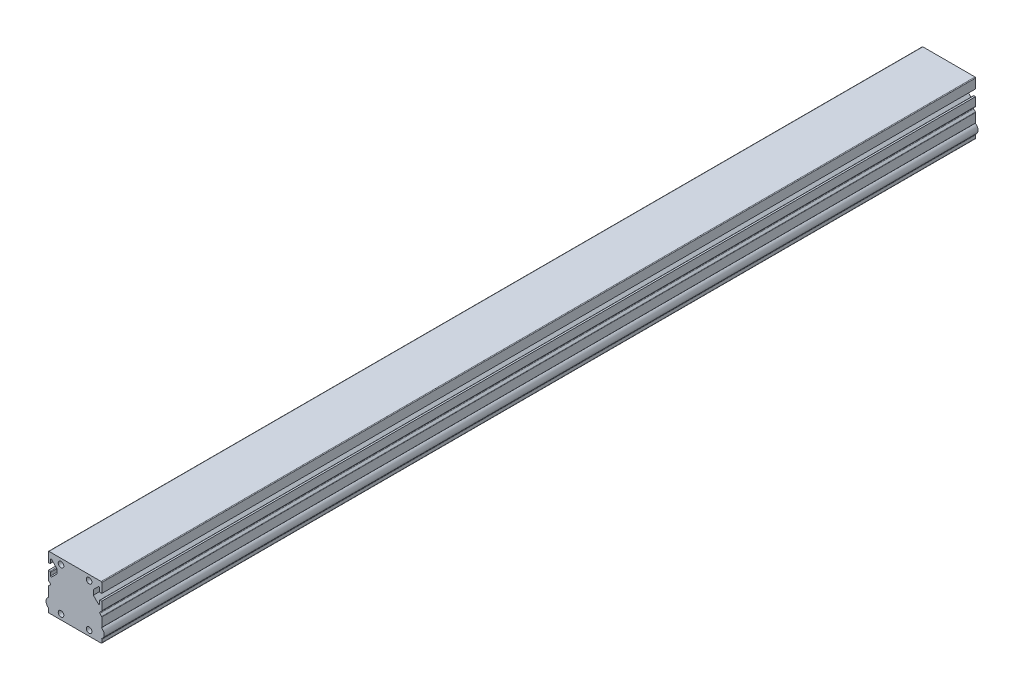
SolidWorks part; units mm, degrees
ref_plane "Ebene vorne" through (0, 0, 0) normal (0, 0, 1) x (1, 0, 0)
ref_plane "Ebene oben" through (0, 0, 0) normal (0, 1, 0) x (1, 0, 0)
ref_plane "Ebene rechts" through (0, 0, 0) normal (1, 0, 0) x (0, 0, -1)
sketch "Skizze1" plane through (0, 0, 0) normal (0, 0, 1) x (1, 0, 0)
  line L0 (0, -28.3625) -> (0, 25.1272) construction
  line L1 (-20, 20) -> (20, 20)
  line L2 (-20, 20) -> (-20, -20)
  line L3 (-20, -20) -> (20, -20)
  line L4 (20, 20) -> (20, -20)
  line L5 (-16.392, 0) -> (38.3918, 0) construction
  dimension "D1" = 40
  dimension "D2" = 40
  dimension "D3" = 20
  dimension "D4" = 20
extrude "Linear austragen1" add sketch "Skizze1" along normal blind 654
sketch "Skizze4" plane through (0, 0, 0) normal (0, 0, -1) x (-1, 0, 0)
  line L0 (20, 20) -> (20, -20) construction
  line L1 (20, -20) -> (-20, -20) construction
  line L2 (17.7, -13.4) -> (10.9489, -6.6489) construction
  line L3 (20, -10.0665) -> (20, -16.7335)
  arc A0 (20, -10.0665) -> (20, -16.7335) centre (17.7, -13.4) ccw
  dimension "D1" = 8.1
  dimension "D2" = 2.3
  dimension "D3" = 6.6
  dimension "D4" = 45
extrude "Schnitt-Linear austragen3" cut sketch "Skizze4" against normal through all
sketch "Skizze5" plane through (0, 0, 0) normal (0, 0, -1) x (-1, 0, 0)
  line L0 (20, 20) -> (20, -10.0665) construction
  line L1 (20, 12.5) -> (20, 7.5)
  line L2 (20, 12.5) -> (18.8, 12.5)
  line L3 (18.3, 13) -> (18.3, 15.25)
  line L4 (17.4464, 15.6036) -> (13.7, 11.8571)
  line L5 (15.296, 10) -> (21.4231, 10) construction
  line L6 (-20, 20) -> (20, 20) construction
  line L7 (20, 7.5) -> (18.8, 7.5)
  line L8 (18.3, 7) -> (18.3, 4.75)
  line L9 (17.4464, 4.3964) -> (13.7, 8.1429)
  line L10 (13.7, 11.8571) -> (13.7, 8.1429)
  arc A0 (17.4464, 15.6036) -> (18.3, 15.25) centre (17.8, 15.25) cw
  arc A1 (18.8, 12.5) -> (18.3, 13) centre (18.8, 13) cw
  arc A2 (18.8, 7.5) -> (18.3, 7) centre (18.8, 7) ccw
  arc A3 (17.4464, 4.3964) -> (18.3, 4.75) centre (17.8, 4.75) ccw
  point P14 (18.3, 12.5)
  dimension "D6" = 0.5
  dimension "D1" = 1.7
  dimension "D2" = 2.5
  dimension "D3" = 10
  dimension "D4" = 45
  dimension "D5" = 6.3
  dimension "D7" = 5.75
extrude "Schnitt-Linear austragen4" cut sketch "Skizze5" against normal through all
sketch "Skizze8" plane through (0, 0, 0) normal (0, 0, -1) x (-1, 0, 0)
  line L0 (20, 7.5) -> (20, -10.0665) construction
  line L1 (20, -2.6485) -> (18.5757, -1.2243)
  line L2 (18.5757, -0.3757) -> (20, 1.0485)
  line L3 (20, 1.0485) -> (20, -2.6485)
  line L4 (17.5007, -0.8) -> (20.0743, -0.8) construction
  line L5 (20, -20) -> (-20, -20) construction
  arc A0 (18.5757, -0.3757) -> (18.5757, -1.2243) centre (19, -0.8) ccw
  point P9 (18.1515, -0.8)
  dimension "D2" = 0.6
  dimension "D1" = 90
  dimension "D3" = 1.6
  dimension "D4" = 19.2
extrude "Schnitt-Linear austragen5" cut sketch "Skizze8" against normal through all
hole_wizard "Ø4.2 (4.2) Durchmesser Bohrung1" positions "Skizze7" profile "Skizze6" hole size "Ø4.2" standard "DIN"
sketch "Skizze7" plane through (0, 0, 0) normal (0, 0, -1) x (-1, 0, 0)
  point P1 (10.5, -16)
  point P3 (10.5, 16)
sketch "Skizze6" plane through (-10.5, -16, 0) normal (1, 0, 0) x (0, 1, 0)
  line L0 (0, 0) -> (0, 654)
  line L1 (0, 654) -> (2.1, 654)
  line L2 (2.1, 654) -> (2.1, 0)
  line L5 (2.1, 0) -> (0, 0)
  line L11 (0, -6.35) -> (0, 107.95) construction
  dimension "Bohrerdurchmesser" = 4.2
  dimension "Bohrungstiefe" = 654
mirror "Spiegeln1" about plane through (0, 0, 0) normal (1, 0, 0) of "Schnitt-Linear austragen5", "Ø4.2 (4.2) Durchmesser Bohrung1", "Schnitt-Linear austragen4", "Schnitt-Linear austragen3"
fillet "Verrundung1" radius 0.3 4 edges at (-20, -16.7335, 327) (-20, -10.0665, 327) (20, -10.0665, 327) (20, -16.7335, 327)
fillet "Verrundung2" radius 0.5 4 edges at (20, 20, 327) (20, -20, 327) (-20, -20, 327) (-20, 20, 327)
fillet "Verrundung3" radius 0.5 4 edges at (-20, -2.6485, 327) (-20, 1.0485, 327) (20, -2.6485, 327) (20, 1.0485, 327)
sketch "Skizze9" plane through (0, 0, 0) normal (0, 0, -1) x (-1, 0, 0)
  circle A0 centre (-17.7, -13.4) radius 4.05
  circle A1 centre (17.7, -13.4) radius 4.05
  dimension "D1" = 8.1
  dimension "D2" = 8.1
extrude "Linear austragen2" add sketch "Skizze9" against normal up to surface (654 mm away)
